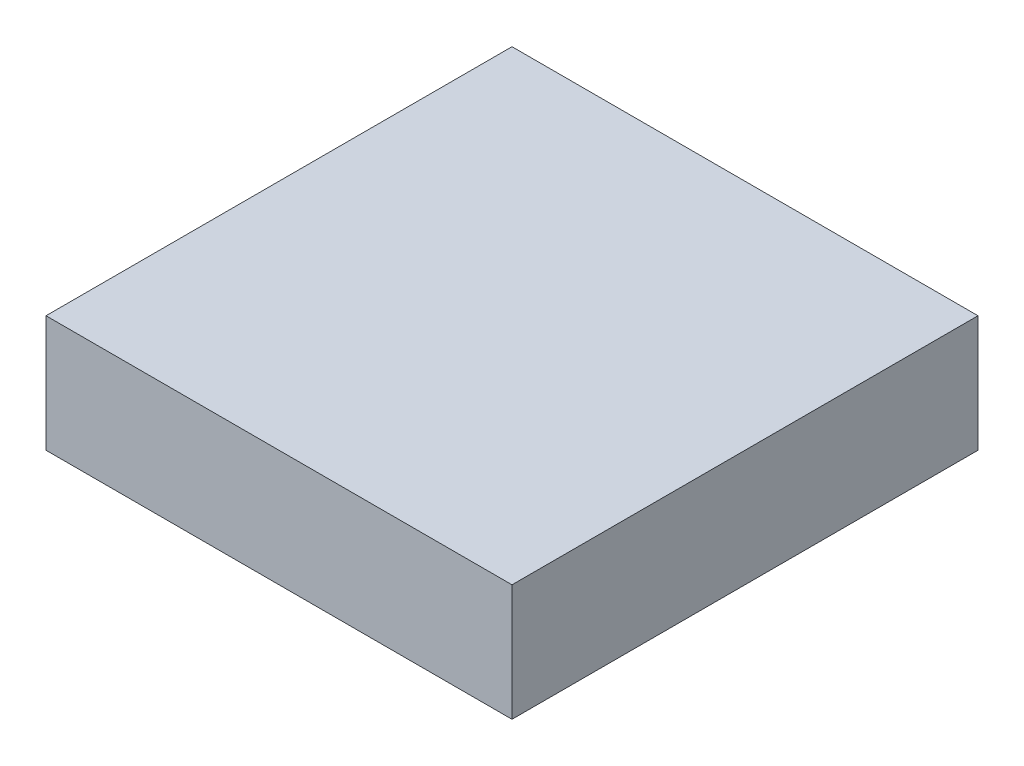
SolidWorks part; units mm, degrees
ref_plane "Front" through (0, 0, 0) normal (0, 0, 1) x (1, 0, 0)
ref_plane "Top" through (0, 0, 0) normal (0, 1, 0) x (1, 0, 0)
ref_plane "Right" through (0, 0, 0) normal (1, 0, 0) x (0, 0, -1)
sketch "Sketch1" plane through (0, 0, 0) normal (0, 1, 0) x (1, 0, 0)
  line L0 (50, -50) -> (-50, 50) construction
  line L1 (-50, 50) -> (50, 50)
  line L2 (-50, 50) -> (-50, -50)
  line L3 (-50, -50) -> (50, -50)
  line L4 (50, 50) -> (50, -50)
  dimension "D1" = 100
  dimension "D2" = 100
extrude "Extrude1" add sketch "Sketch1" along normal blind 25
sketch "Sketch2" plane through (0, 25, 0) normal (0, 1, 0) x (1, 0, 0)
  circle A0 centre (-29.8538, -38.3821) radius 7.8295
